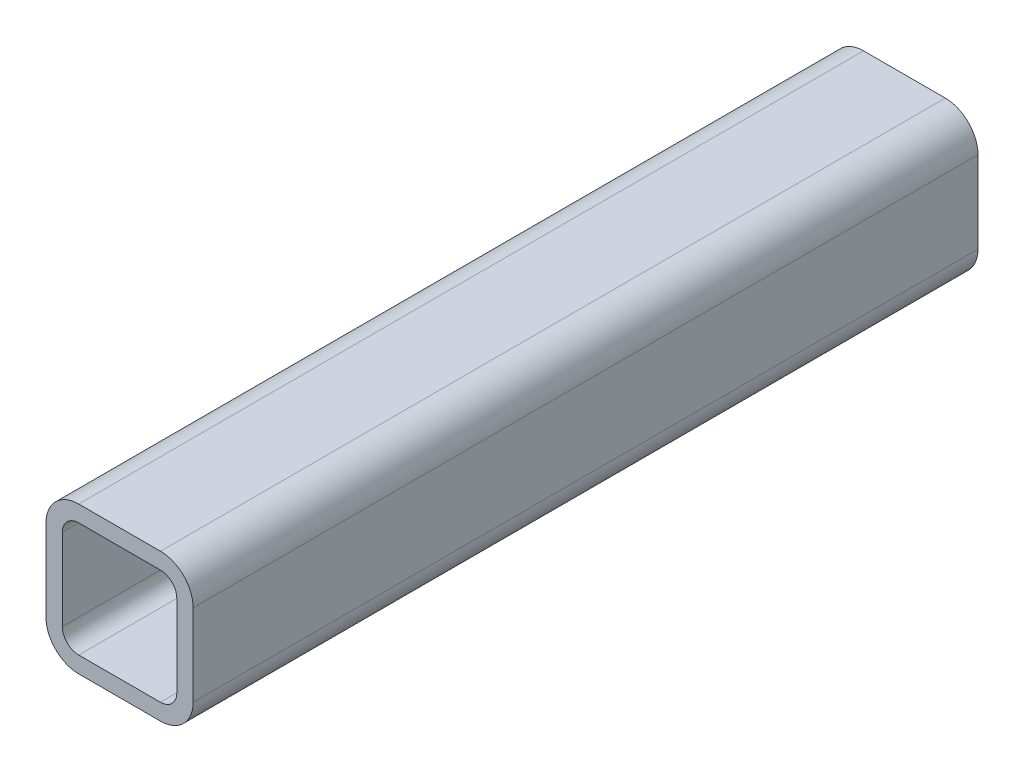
SolidWorks part; units mm, degrees
ref_plane "Front Plane" through (0, 0, 0) normal (0, 0, 1) x (1, 0, 0)
ref_plane "Top Plane" through (0, 0, 0) normal (0, 1, 0) x (1, 0, 0)
ref_plane "Right Plane" through (0, 0, 0) normal (1, 0, 0) x (0, 0, -1)
sketch "Sketch1" plane through (0, 0, 0) normal (0, 0, 1) x (1, 0, 0)
sketch_block_instance "HSS2.25x2.25x0.250-1"
sketch_block "HSS2.25x2.25x0.250"
extrude "Boss-Extrude1" add sketch "Sketch1" along normal blind 304.8
